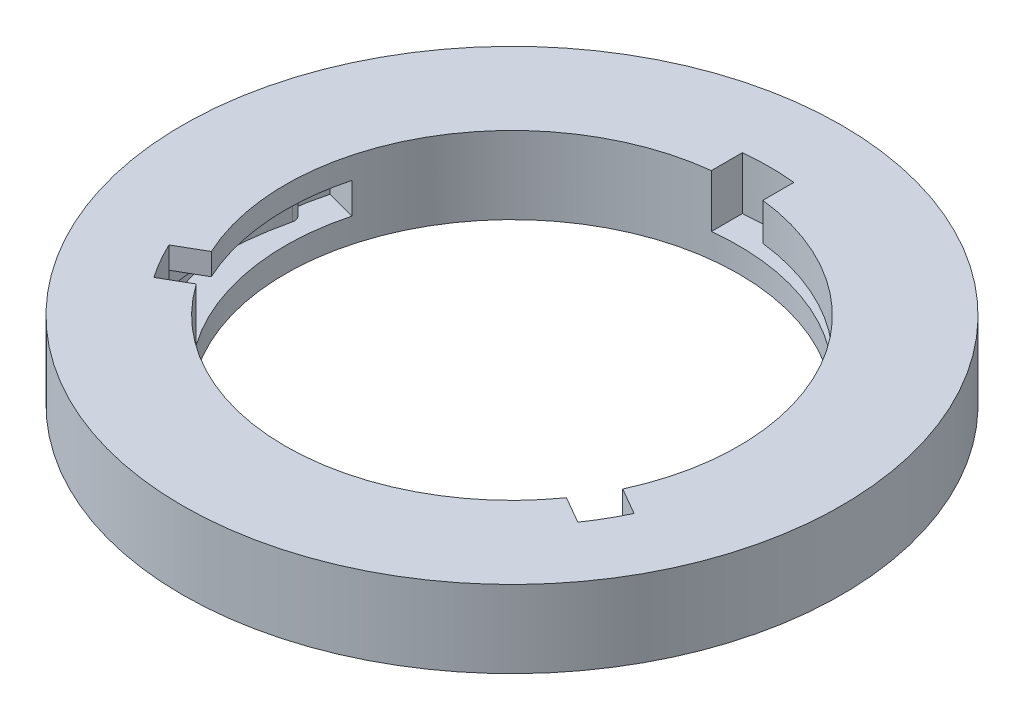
SolidWorks part; units mm, degrees
ref_plane "Plan de face" through (0, 0, 0) normal (0, 0, 1) x (1, 0, 0)
ref_plane "Plan de dessus" through (0, 0, 0) normal (0, 1, 0) x (1, 0, 0)
ref_plane "Plan de droite" through (0, 0, 0) normal (1, 0, 0) x (0, 0, -1)
sketch "Esquisse2" plane through (0, 0, 0) normal (0, 0, 1) x (1, 0, 0)
  line L0 (0, 40.3076) -> (0, -38.1147) construction
  line L1 (44, 0) -> (64, 0)
  line L2 (44, 0) -> (44, 15)
  line L3 (44, 15) -> (64, 15)
  line L4 (64, 0) -> (64, 15)
  dimension "D1" = 15
  dimension "D2" = 20
  dimension "D3" = 44
revolve "Révolution3" add sketch "Esquisse2" angle 360 about L0
sketch "Esquisse4" plane through (0, 15, 0) normal (0, 1, 0) x (1, 0, 0)
  line L0 (5, 49.7494) -> (5, 43.715)
  line L1 (-5, 49.7494) -> (-5, 43.715)
  arc A0 (5, 49.7494) -> (-5, 49.7494) centre (0, 0) ccw
  circle A1 centre (0, 0) radius 44 construction
  arc A2 (5, 43.715) -> (-5, 43.715) centre (0, 0) ccw
  dimension "D1" = 100
  dimension "D2" = 5
  dimension "D3" = 10
extrude "Enlèv. mat.-Extru.1" cut sketch "Esquisse4" against normal blind 10.25
sketch "Esquisse5" plane through (0, 15, 0) normal (0, 1, 0) x (1, 0, 0)
  line L0 (-45.1625, -21.4558) -> (-39.9473, -18.4448)
  line L1 (-41.1625, -28.384) -> (-35.9473, -25.373)
  line L2 (-8.25, 0) -> (8.25, 0) construction
  arc A0 (-45.1625, -21.4558) -> (-41.1625, -28.384) centre (0, 0) ccw
  arc A1 (-5, 43.715) -> (5, 43.715) centre (0, 0) ccw construction
  arc A2 (-39.9473, -18.4448) -> (-35.9473, -25.373) centre (0, 0) ccw
  dimension "D1" = 100
  dimension "D2" = 8
  dimension "D3" = 4
  dimension "D4" = 30
extrude "Enlèv. mat.-Extru.2" cut sketch "Esquisse5" against normal blind 10.25
pattern_circular "Répétition circulaire1" count 2 every 120 about axis through (0, 0, 0) along (0, 1, 0) of "Enlèv. mat.-Extru.2"
sketch "Esquisse6" plane through (0, 0, 0) normal (-1, 0, 0) x (0, 0, 1)
  line L0 (-44, 7.75) -> (-50, 7.75)
  line L4 (-50, 4.75) -> (-44, 4.75)
  line L5 (-50, 7.75) -> (-50, 4.75)
  line L6 (-44, 7.75) -> (-44, 4.75)
  line L7 (64, 15) -> (-64, 15) construction
  line L8 (0, 0) -> (0, 15) construction
  point P10 (-43.715, 10.7284)
  dimension "D1" = 3
  dimension "D2" = 10.25
  dimension "D3" = 50
  dimension "D4" = 44
revolve "Enlèvement de matière-Révolution1" cut sketch "Esquisse6" angle 45 about axis through (0, 40.3076, 0) along (0, 1, 0)
pattern_circular "Répétition circulaire2" count 3 over 360 about axis through (0, 0, 0) along (0, 1, 0) of "Enlèvement de matière-Révolution1"
sketch "Esquisse9" plane through (0, 7.75, 0) normal (0, -1, 0) x (1, 0, 0)
  line L0 (41.1625, 28.384) -> (35.9473, 25.373) construction
  line L1 (41.1625, 28.384) -> (35.9473, 25.373)
  arc A0 (18.9859, 39.693) -> (41.1625, 28.384) centre (3.4095, -18.2498) cw
  arc A1 (35.9473, 25.373) -> (11.388, 42.5007) centre (0, 0) ccw construction
  arc A2 (35.9473, 25.373) -> (18.9859, 39.693) centre (0, 0) ccw
  dimension "D2" = 60
  dimension "D1" = 8.1
extrude "Enlèv. mat.-Extru.3" cut sketch "Esquisse9" against normal blind 3
ref_plane "Plan1" through (0, 0, 0) normal (0.9021, 0, -0.4315) x (-0.4315, 0, -0.9021)
sketch "Esquisse10" plane through (0, 0, 0) normal (0.9659, 0, -0.2588) x (-0.2588, 0, -0.9659)
  line L0 (-44, 7.75) -> (-44, 10.75)
  line L1 (-44, 15) -> (-44, 7.75) construction
  line L2 (-44, 7.75) -> (-50, 7.75) construction
  line L3 (-44, 7.75) -> (-50, 7.75)
  line L4 (-43.2544, 10.75) -> (-33.8123, 10.75) construction
  line L6 (-50, 7.75) -> (-50, 10.75)
  line L7 (-50, 10.75) -> (-44, 10.75)
revolve "Enlèvement de matière-Révolution2" cut sketch "Esquisse10" angle 10.56 about axis through (0, 40.3076, 0) along (0, 1, 0)
sketch "Esquisse12" plane through (0, 7.75, 0) normal (0, -1, 0) x (1, 0, 0)
  line L2 (21.5728, 45.1067) -> (18.9841, 39.6939)
  line L3 (18.9841, 39.6939) -> (18.9859, 39.693)
  line L4 (19.7507, 41.2969) -> (18.9841, 39.6939)
  line L5 (18.9841, 39.6939) -> (18.9859, 39.693)
  arc A0 (19.7507, 41.2969) -> (20.6724, 39.2131) centre (21.1039, 40.6497) ccw
  arc A2 (41.1625, 28.384) -> (18.9859, 39.693) centre (3.4095, -18.2498) ccw
  arc A3 (41.1625, 28.384) -> (21.5728, 45.1067) centre (0, 0) ccw
  arc A4 (20.6724, 39.2131) -> (18.9859, 39.693) centre (3.4095, -18.2498) ccw
  point P8 (21.6964, 41.0041)
  point P9 (22.2712, 41.2793)
  dimension "D2" = 3
  dimension "D1" = 0
extrude "Enlèv. mat.-Extru.4" cut sketch "Esquisse12" against normal up to surface (3 mm away)
pattern_circular "Répétition circulaire3" count 2 every 120 about axis through (0, 0, 0) along (0, 1, 0) of "Enlèv. mat.-Extru.3", "Enlèv. mat.-Extru.4", "Enlèvement de matière-Révolution2"
